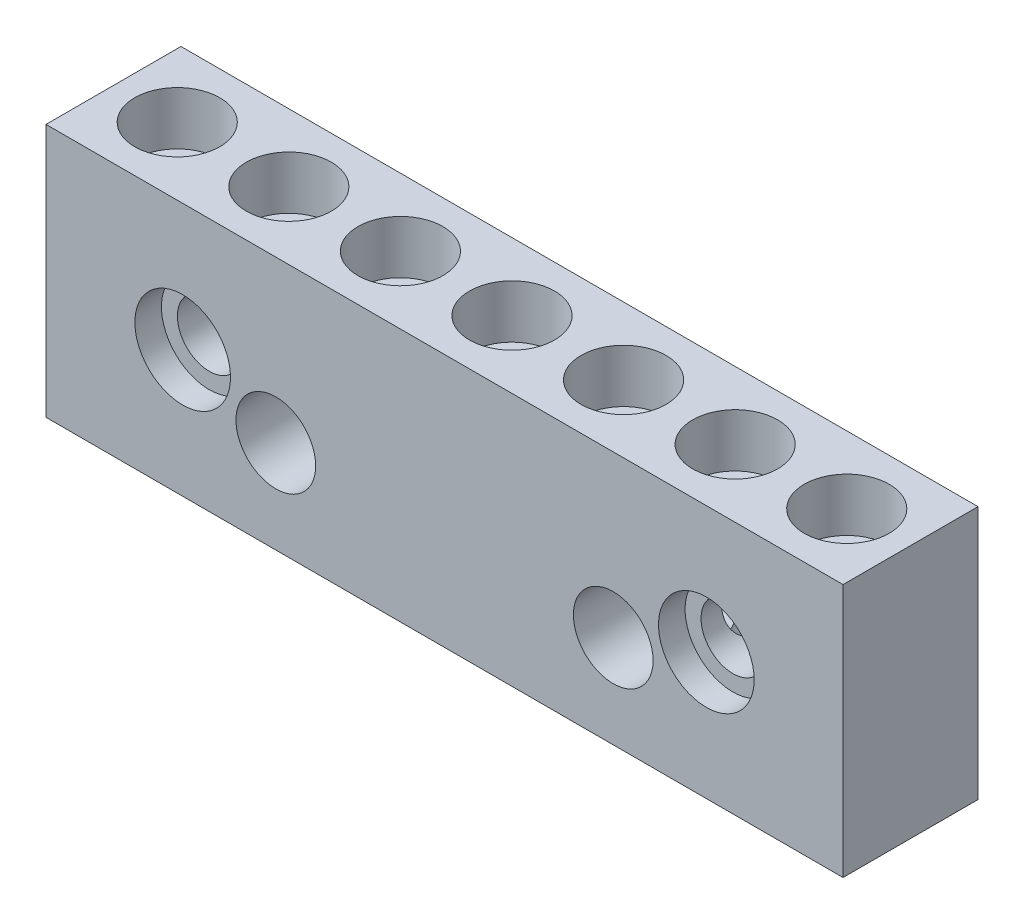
SolidWorks part; units mm, degrees
ref_plane "Front Plane" through (0, 0, 0) normal (0, 0, 1) x (1, 0, 0)
ref_plane "Top Plane" through (0, 0, 0) normal (0, 1, 0) x (1, 0, 0)
ref_plane "Right Plane" through (0, 0, 0) normal (1, 0, 0) x (0, 0, -1)
sketch "Sketch1" plane through (0, 0, 0) normal (0, 0, 1) x (1, 0, 0)
  line L1 (75, -23.875) -> (-75, -23.875)
  line L2 (75, -23.875) -> (75, 23.875)
  line L3 (75, 23.875) -> (-75, 23.875)
  line L4 (-75, -23.875) -> (-75, 23.875)
  line L5 (75, -23.875) -> (-75, 23.875) construction
  line L6 (75, 23.875) -> (-75, -23.875) construction
  point P0 (0, 0)
  dimension "D1" = 150
  dimension "D2" = 47.75
extrude "Boss-Extrude1" add sketch "Sketch1" along normal mid plane 25.4
sketch "Sketch2" plane through (0, 0, 0) normal (0, 0, 1) x (1, 0, 0)
  line L0 (0, 32.0168) -> (0, -37.0588) construction
sketch "Sketch3" plane through (0, 0, 12.7) normal (0, 0, 1) x (1, 0, 0)
  line L0 (-75, 23.875) -> (-75, -23.875) construction
  line L1 (-75, -23.875) -> (75, -23.875) construction
  circle A0 centre (-31.75, -6.405) radius 7.5
  circle A1 centre (31.75, -6.405) radius 7.5
  point P9 (-31.75, -6.405)
  point P10 (31.75, -6.405)
  dimension "D4" = 15
  dimension "D1" = 63.5
  dimension "D2" = 43.25
  dimension "D3" = 17.47
extrude "Cut-Extrude1" cut sketch "Sketch3" against normal up to surface (25.4 mm away)
sketch "Sketch4" plane through (0, 0, 12.7) normal (0, 0, 1) x (1, 0, 0)
  line L0 (-75, 23.875) -> (-75, -23.875) construction
  line L1 (-75, -23.875) -> (75, -23.875) construction
  circle A0 centre (-49.275, -0.005) radius 9
  circle A1 centre (49.275, -0.005) radius 9
  point P9 (49.275, -0.005)
  point P10 (-49.275, -0.005)
  dimension "D1" = 18
  dimension "D2" = 98.55
  dimension "D3" = 25.725
  dimension "D4" = 23.87
extrude "Cut-Extrude2" cut sketch "Sketch4" against normal blind 5
sketch "Sketch5" plane through (0, 0, 7.7) normal (0, 0, 1) x (1, 0, 0)
  circle A0 centre (-49.275, -0.005) radius 6
  circle A1 centre (49.275, -0.005) radius 6
  dimension "D1" = 12
extrude "Cut-Extrude3" cut sketch "Sketch5" against normal up to surface (20.4 mm away)
sketch "Sketch6" plane through (0, 23.875, 0) normal (0, 1, 0) x (1, 0, 0)
  line L0 (-75, -12.7) -> (-75, 12.7) construction
  circle A0 centre (-63, 0) radius 8
  point P2 (0, 0)
  point P6 (-63, 0)
  dimension "D1" = 16
  dimension "D2" = 12
extrude "Cut-Extrude4" cut sketch "Sketch6" against normal blind 10
sketch "Sketch7" plane through (0, 13.875, 0) normal (0, 1, 0) x (1, 0, 0)
  circle A0 centre (-63, 0) radius 4
  dimension "D1" = 8
extrude "Cut-Extrude5" cut sketch "Sketch7" against normal up to surface (37.75 mm away)
pattern_linear "LPattern1" count 7 spacing 21 along (1, 0, 0) of "Cut-Extrude4", "Cut-Extrude5"
